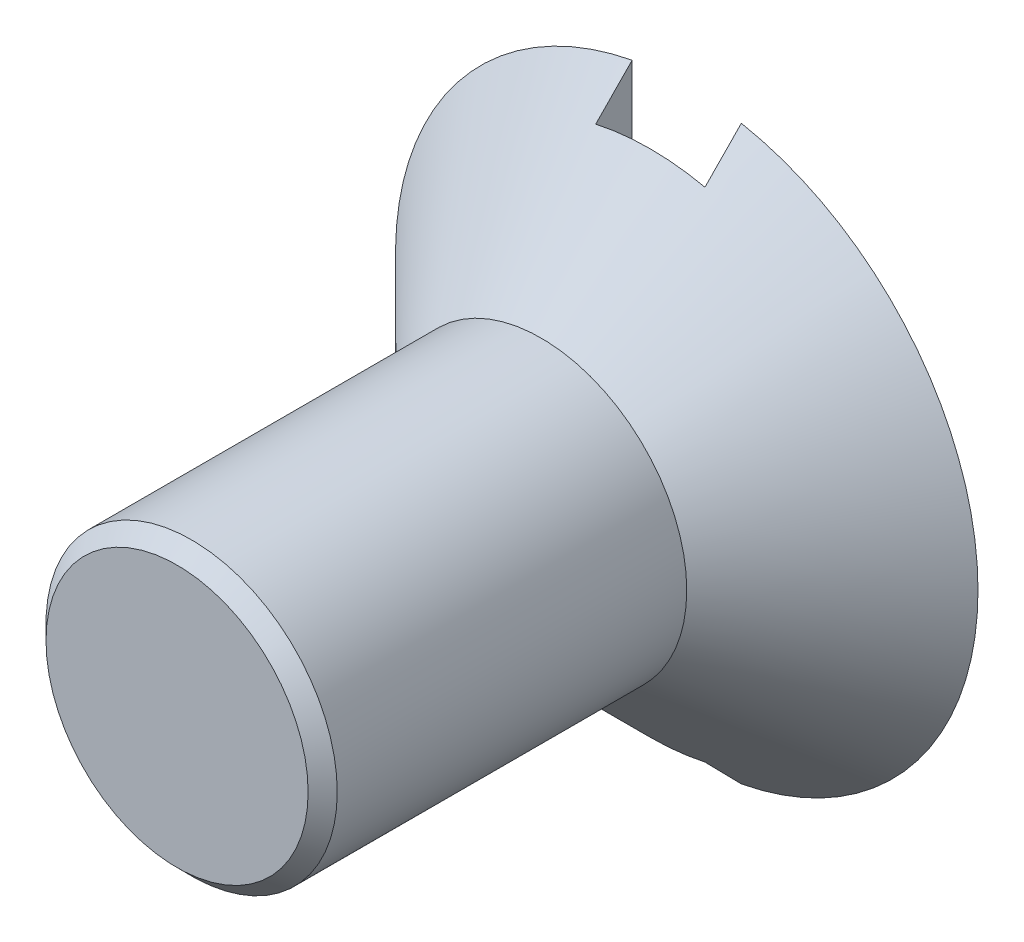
SolidWorks part; units mm, degrees
ref_plane "Plan de face" through (0, 0, 0) normal (0, 0, 1) x (1, 0, 0)
ref_plane "Plan de dessus" through (0, 0, 0) normal (0, 1, 0) x (1, 0, 0)
ref_plane "Plan de droite" through (0, 0, 0) normal (1, 0, 0) x (0, 0, -1)
sketch "Esquisse1" plane through (0, 0, 0) normal (0, 0, 1) x (1, 0, 0)
  circle A1 centre (0, 0) radius 4
  dimension "D2" = 8
extrude "Boss.-Extru.1" add sketch "Esquisse1" along normal blind 2
sketch "Esquisse2" plane through (0, 0, 2) normal (0, 0, 1) x (1, 0, 0)
  circle A0 centre (0, 0) radius 2
  dimension "D1" = 4
extrude "Boss.-Extru.2" add sketch "Esquisse2" along normal blind 5
chamfer "Chanfrein1" distance 0.2 angle 45 1 edges at (2, 0, 7)
chamfer "Chanfrein2" distance 2 angle 45 1 edges at (4, 0, 2)
sketch "Esquisse3" plane through (0, 0, 0) normal (0, 0, -1) x (-1, 0, 0)
  line L1 (-0.75, 5) -> (0.75, 5)
  line L2 (-0.75, 5) -> (-0.75, -5)
  line L3 (-0.75, -5) -> (0.75, -5)
  line L4 (0.75, 5) -> (0.75, -5)
  dimension "D1" = 1.5
  dimension "D2" = 0.75
  dimension "D3" = 5
  dimension "D4" = 10
extrude "Enlèv. mat.-Extru.1" cut sketch "Esquisse3" against normal blind 0.5
